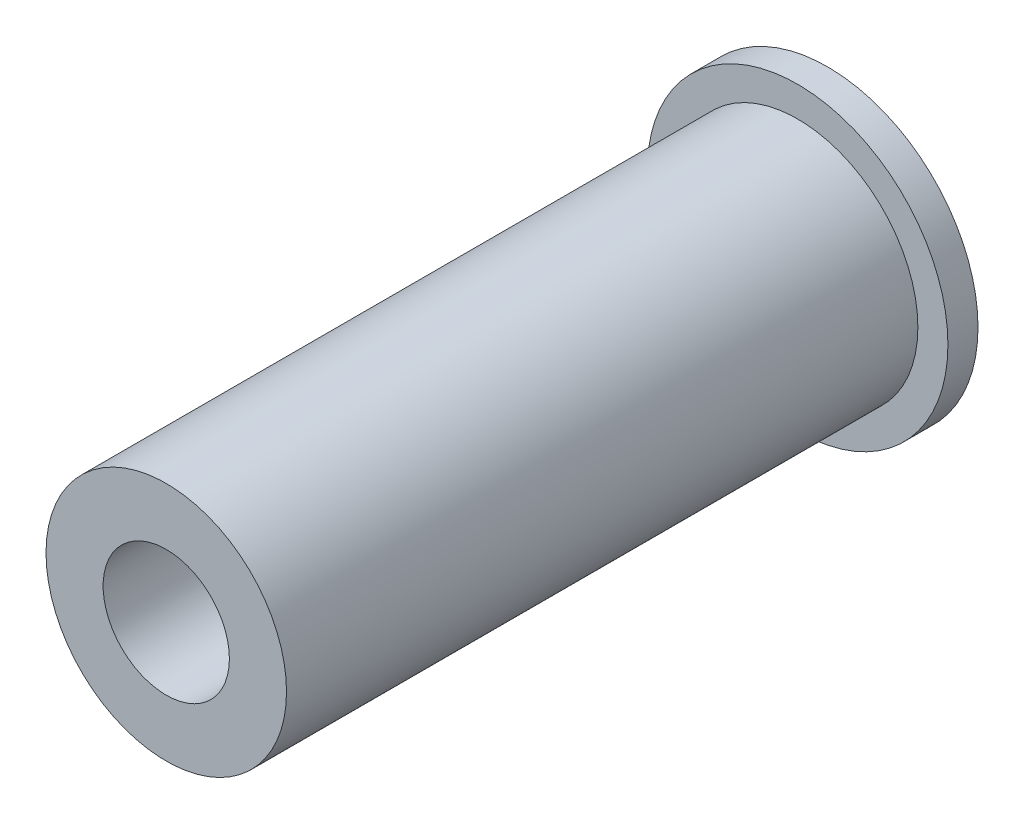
SolidWorks part; units mm, degrees
ref_plane "Plan de face" through (0, 0, 0) normal (0, 0, 1) x (1, 0, 0)
ref_plane "Plan de dessus" through (0, 0, 0) normal (0, 1, 0) x (1, 0, 0)
ref_plane "Plan de droite" through (0, 0, 0) normal (1, 0, 0) x (0, 0, -1)
sketch "Esquisse1" plane through (0, 0, 0) normal (0, 0, 1) x (1, 0, 0)
  circle A0 centre (0, 0) radius 5
extrude "Extrusion1" add sketch "Esquisse1" along normal blind 22
sketch "Esquisse2" plane through (0, 0, 22) normal (0, 0, 1) x (1, 0, 0)
  circle A0 centre (0, 0) radius 4
extrude "Extrusion2" cut sketch "Esquisse2" against normal blind 21 flip side to cut
chamfer "Chanfrein1" [suppressed] distance 1 angle 45
sketch "Esquisse3" plane through (0, 0, 22) normal (0, 0, 1) x (1, 0, 0)
  circle A0 centre (0, 0) radius 2.1
extrude "Extrusion3" cut sketch "Esquisse3" against normal blind 22
